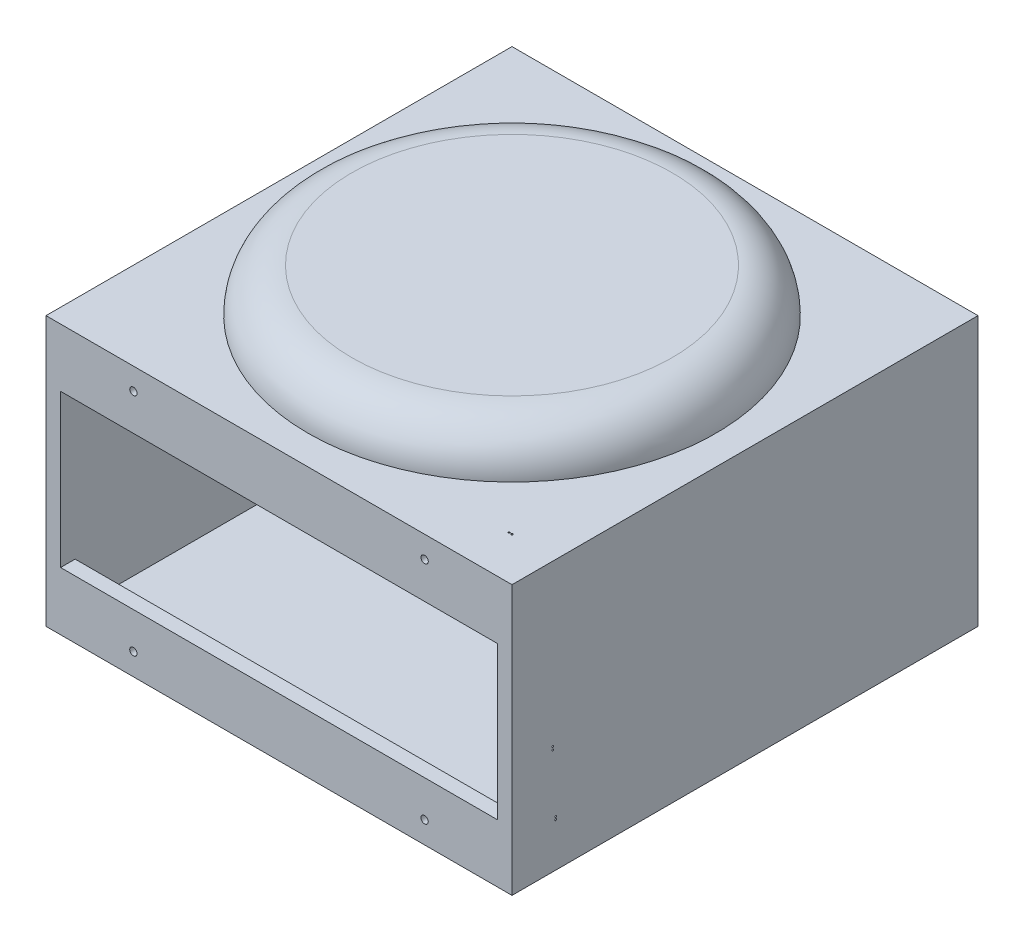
SolidWorks part; units mm, degrees
ref_plane "Front Plane" through (0, 0, 0) normal (0, 0, 1) x (1, 0, 0)
ref_plane "Top Plane" through (0, 0, 0) normal (0, 1, 0) x (1, 0, 0)
ref_plane "Right Plane" through (0, 0, 0) normal (1, 0, 0) x (0, 0, -1)
sketch "Sketch1" plane through (0, 0, 0) normal (0, 0, 1) x (1, 0, 0)
  line L1 (0, 0) -> (203.2, 0)
  line L2 (0, 0) -> (0, 117.348)
  line L3 (0, 117.348) -> (203.2, 117.348)
  line L4 (203.2, 0) -> (203.2, 117.348)
  dimension "D1" = 203.2
  dimension "D2" = 117.348
extrude "Boss-Extrude1" add sketch "Sketch1" along normal blind 203.2
sketch "Sketch2" plane through (0, 0, 203.2) normal (0, 0, 1) x (1, 0, 0)
  line L0 (203.2, 117.348) -> (0, 117.348) construction
  line L1 (6.35, 6.35) -> (196.85, 6.35)
  line L2 (6.35, 6.35) -> (6.35, 110.998)
  line L3 (6.35, 110.998) -> (196.85, 110.998)
  line L4 (196.85, 6.35) -> (196.85, 110.998)
  line L5 (203.2, 0) -> (203.2, 117.348) construction
  line L6 (0, 117.348) -> (0, 0) construction
  line L7 (0, 0) -> (203.2, 0) construction
  dimension "D1" = 6.35
  dimension "D2" = 6.35
  dimension "D3" = 6.35
  dimension "D4" = 6.35
extrude "Cut-Extrude1" cut sketch "Sketch2" against normal blind 196.85
sketch "Sketch4" plane through (0, 110.998, 0) normal (0, -1, 0) x (1, 0, 0)
  line L0 (196.85, 6.35) -> (196.85, 203.2) construction
  line L1 (6.35, 203.2) -> (196.85, 203.2)
  line L2 (6.35, 203.2) -> (6.35, 196.85)
  line L3 (6.35, 196.85) -> (196.85, 196.85)
  line L4 (196.85, 203.2) -> (196.85, 196.85)
  dimension "D1" = 6.35
extrude "Boss-Extrude3" add sketch "Sketch4" along normal blind 19.05
sketch "Sketch5" plane through (0, 6.35, 0) normal (0, 1, 0) x (1, 0, 0)
  line L0 (196.85, -6.35) -> (196.85, -203.2) construction
  line L1 (6.35, -203.2) -> (196.85, -203.2)
  line L2 (6.35, -203.2) -> (6.35, -196.85)
  line L3 (6.35, -196.85) -> (196.85, -196.85)
  line L4 (196.85, -203.2) -> (196.85, -196.85)
  dimension "D1" = 6.35
extrude "Boss-Extrude4" add sketch "Sketch5" along normal blind 19.05
sketch "Sketch6" plane through (0, 0, 203.2) normal (0, 0, 1) x (1, 0, 0)
  line L2 (196.85, 6.35) -> (196.85, 110.998) construction
  line L3 (196.85, 9.525) -> (38.1, 9.525)
  line L4 (38.1, 9.525) -> (38.1, 107.823)
  line L6 (0, 117.348) -> (0, 0) construction
  line L10 (0, 0) -> (203.2, 0) construction
  line L12 (38.1, 107.823) -> (165.1, 107.823)
  line L13 (165.1, 107.823) -> (165.1, 9.525) construction
  line L14 (203.2, 117.348) -> (0, 117.348) construction
  circle A0 centre (38.1, 107.823) radius 1.5875
  circle A1 centre (165.1, 107.823) radius 1.5875
  circle A2 centre (165.1, 9.525) radius 1.5875
  circle A3 centre (38.1, 9.525) radius 1.5875
  dimension "D5" = 3.175
  dimension "D1" = 38.1
  dimension "D2" = 127
  dimension "D3" = 9.525
  dimension "D4" = 9.525
extrude "Cut-Extrude2" cut sketch "Sketch6" against normal up to next contours A0 | A1 | A2 | A3
sketch "Sketch7" plane through (0, 117.348, 0) normal (0, 1, 0) x (1, 0, 0)
  line L0 (0, -203.2) -> (203.2, 0) construction
  circle A0 centre (101.6, -101.6) radius 88.9
  dimension "D1" = 177.8
extrude "Boss-Extrude5" add sketch "Sketch7" along normal blind 19.05
sketch "Sketch8" plane through (0, 136.398, 0) normal (0, 1, 0) x (1, 0, 0)
  circle A0 centre (101.6, -101.6) radius 88.9
  dimension "D1" = 177.8
fillet "Fillet1" radius 19.05 1 edges at (101.6, 136.398, 190.5)
sketch "Sketch9" plane through (0, 0, 0) normal (0, -1, 0) x (1, 0, 0)
  circle A0 centre (101.6, 101.6) radius 88.9
  dimension "D1" = 177.8
extrude "Boss-Extrude6" add sketch "Sketch9" along normal blind 19.05
fillet "Fillet3" radius 19.05 1 edges at (101.6, -19.05, 12.7)
sketch "Sketch10" plane through (203.2, 0, 0) normal (1, 0, 0) x (0, 0, -1)
  line L0 (-203.2, 0) -> (-203.2, 117.348) construction
  circle A0 centre (-185.42, 47.3334) radius 0.381
  circle A1 centre (-185.42, 46.0634) radius 0.381
  dimension "D1" = 0.762
  dimension "D2" = 0.762
  dimension "D3" = 1.27
  dimension "D4" = 17.78
extrude "Cut-Extrude4" cut sketch "Sketch10" against normal blind 3.81
sketch "Sketch11" plane through (0, 0, 0) normal (0, -1, 0) x (1, 0, 0)
  line L0 (0, 177.3427) -> (203.2, 177.3427) construction
  line L1 (0, 203.2) -> (0, 0) construction
  line L2 (203.2, 203.2) -> (203.2, 0) construction
  line L3 (0, 203.2) -> (203.2, 203.2)
  line L4 (203.2, 203.2) -> (203.2, 177.3427)
  line L5 (0, 203.2) -> (0, 177.3427)
  circle A0 centre (19.05, 183.6927) radius 0.381
  circle A1 centre (20.32, 183.6927) radius 0.381
  circle A2 centre (182.88, 183.6927) radius 0.381
  circle A3 centre (184.15, 183.6927) radius 0.381
  dimension "D1" = 0.762
  dimension "D2" = 1.27
  dimension "D3" = 19.05
  dimension "D4" = 1.27
  dimension "D5" = 19.05
  dimension "D6" = 6.35
  dimension "D7" = 6.35
extrude "Cut-Extrude5" cut sketch "Sketch11" against normal blind 7.62 contours A0 | A1 | A2 | A3
sketch "Sketch13" plane through (203.2, 0, 0) normal (1, 0, 0) x (0, 0, -1)
  line L0 (-203.2, 0) -> (-184.15, 0)
  line L1 (-203.2, 0) -> (0, 0) construction
  circle A0 centre (-184.15, 19.05) radius 0.381
  circle A1 centre (-184.15, 20.32) radius 0.381
  dimension "D1" = 0.762
  dimension "D2" = 1.27
  dimension "D3" = 19.05
  dimension "D4" = 19.05
  dimension "D5" = 19.05
extrude "Cut-Extrude6" cut sketch "Sketch13" against normal blind 7.62 contours A0 | A1
sketch "Sketch15" plane through (0, 117.348, 0) normal (0, 1, 0) x (1, 0, 0)
  line L0 (203.2, -203.2) -> (203.2, -184.0365)
  line L1 (203.2, -203.2) -> (203.2, 0) construction
  line L2 (203.2, -203.2) -> (0, -203.2) construction
  circle A0 centre (184.15, -184.15) radius 0.381
  circle A1 centre (182.88, -184.15) radius 0.381
  dimension "D1" = 0.762
  dimension "D2" = 19.05
  dimension "D3" = 19.05
  dimension "D4" = 19.05
  dimension "D5" = 1.27
extrude "Cut-Extrude7" cut sketch "Sketch15" against normal blind 7.62 contours A0 | A1
sketch "Sketch16" plane through (0, 0, 0) normal (-1, 0, 0) x (0, 0, 1)
  line L0 (203.2, 117.348) -> (0, 117.348) construction
  line L1 (203.2, 117.348) -> (203.2, 0) construction
  circle A0 centre (184.15, 98.298) radius 0.381
  circle A1 centre (184.15, 97.028) radius 0.381
  dimension "D1" = 0.762
  dimension "D2" = 1.27
  dimension "D3" = 19.05
  dimension "D4" = 19.05
extrude "Cut-Extrude8" cut sketch "Sketch16" against normal blind 7.62 contours A0 | A1
sketch "Sketch17" plane through (0, 0, 0) normal (0, 0, -1) x (-1, 0, 0)
  line L0 (-203.2, 117.348) -> (0, 117.348) construction
  line L1 (-196.85, 110.998) -> (-6.35, 110.998)
  line L2 (-196.85, 110.998) -> (-196.85, 6.35)
  line L3 (-196.85, 6.35) -> (-6.35, 6.35)
  line L4 (-6.35, 110.998) -> (-6.35, 6.35)
  line L5 (-203.2, 0) -> (-203.2, 117.348) construction
  line L6 (-190.5, 0) -> (-12.7, 0) construction
  line L7 (0, 117.348) -> (0, 0) construction
  dimension "D1" = 6.35
  dimension "D2" = 6.35
  dimension "D3" = 6.35
  dimension "D4" = 6.35
extrude "Cut-Extrude9" cut sketch "Sketch17" against normal up to next
